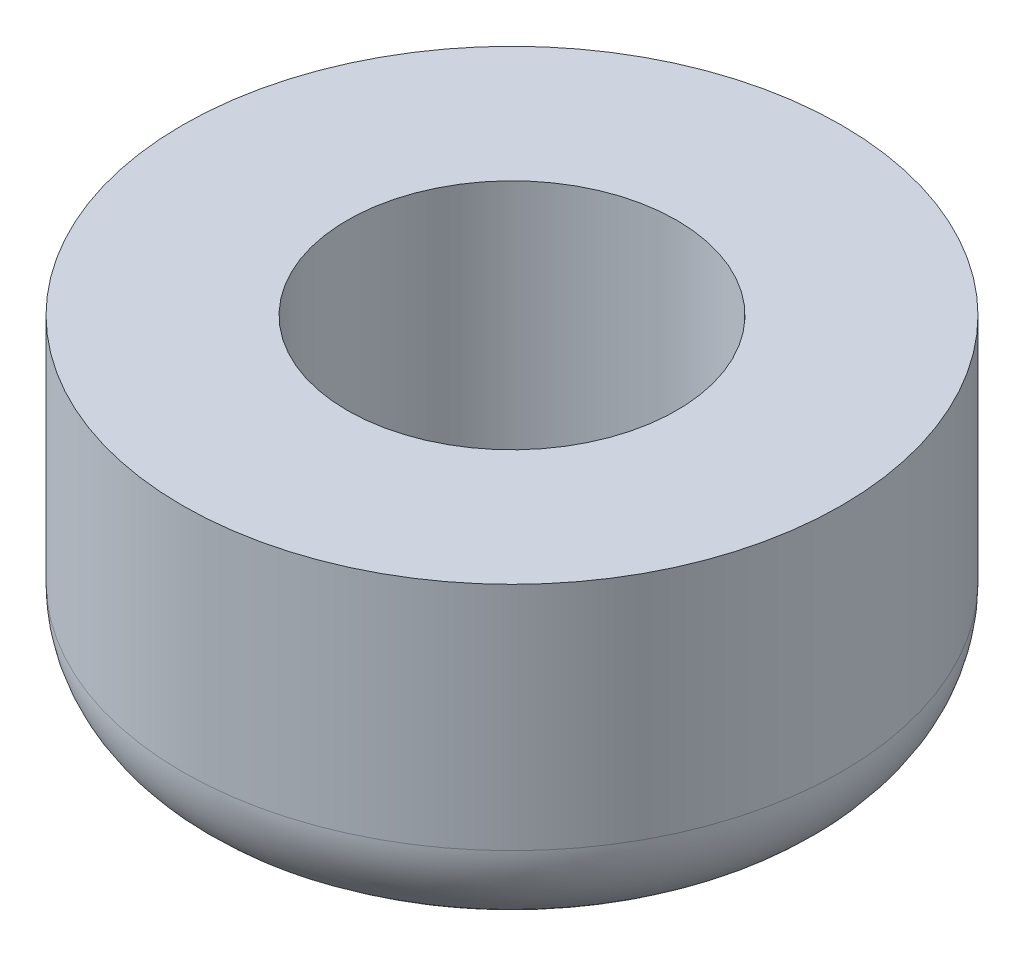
SolidWorks part; units mm, degrees
ref_plane "Front Plane" through (0, 0, 0) normal (0, 0, 1) x (1, 0, 0)
ref_plane "Top Plane" through (0, 0, 0) normal (0, 1, 0) x (1, 0, 0)
ref_plane "Right Plane" through (0, 0, 0) normal (1, 0, 0) x (0, 0, -1)
sketch "Sketch_Check Valve" plane through (0, 0, 0) normal (0, 1, 0) x (1, 0, 0)
  circle A0 centre (0, 0) radius 10
  circle A1 centre (0, 0) radius 5
  dimension "D1" = 20
  dimension "D2" = 5
extrude "Check Valve" add sketch "Sketch_Check Valve" against normal blind 10
fillet "Fillet1" radius 3 1 edges at (0, -10, 10)
